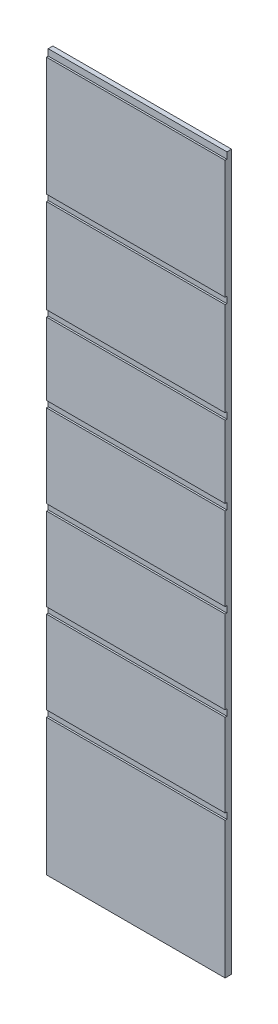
SolidWorks part; units mm, degrees
ref_plane "Plano frontal" through (0, 0, 0) normal (0, 0, 1) x (1, 0, 0)
ref_plane "Plano superior" through (0, 0, 0) normal (0, 1, 0) x (1, 0, 0)
ref_plane "Plano direito" through (0, 0, 0) normal (1, 0, 0) x (0, 0, -1)
body saved out of another part "Bruto-Lateral 1 Movel 3-1"
